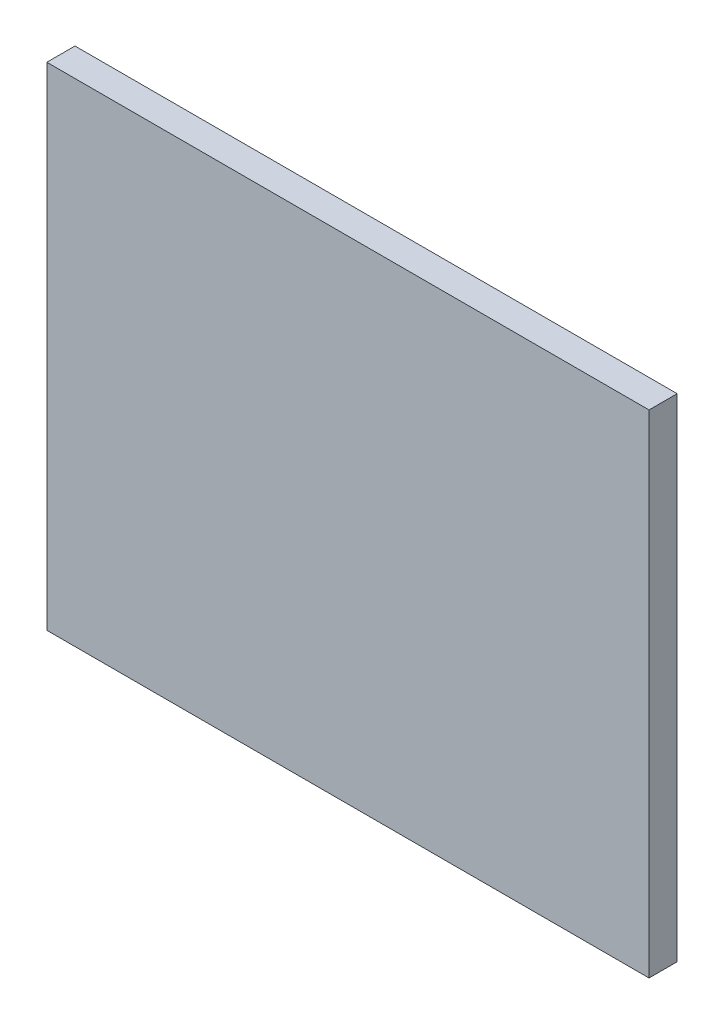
SolidWorks part; units mm, degrees
ref_plane "Vorne" through (0, 0, 0) normal (0, 0, 1) x (1, 0, 0)
ref_plane "Oben" through (0, 0, 0) normal (0, 1, 0) x (1, 0, 0)
ref_plane "Rechts" through (0, 0, 0) normal (1, 0, 0) x (0, 0, -1)
sketch "Skizze1" plane through (0, 0, 0) normal (0, 0, 1) x (1, 0, 0)
  line L1 (-51.6054, 38.2301) -> (55.3968, 38.2301)
  line L2 (-51.6054, 38.2301) -> (-51.6054, -49.1831)
  line L3 (-51.6054, -49.1831) -> (55.3968, -49.1831)
  line L4 (55.3968, 38.2301) -> (55.3968, -49.1831)
extrude "Linear austragen1" add sketch "Skizze1" along normal blind 5
sketch "Skizze2"
